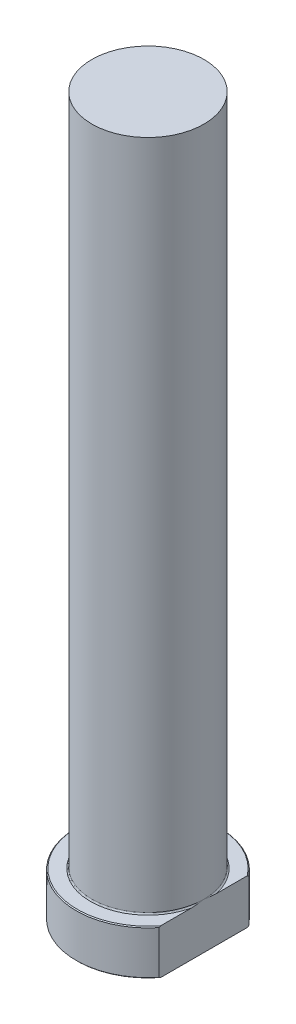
SolidWorks part; units mm, degrees
ref_plane "Front Plane" through (0, 0, 0) normal (0, 0, 1) x (1, 0, 0)
ref_plane "Top Plane" through (0, 0, 0) normal (0, 1, 0) x (1, 0, 0)
ref_plane "Right Plane" through (0, 0, 0) normal (1, 0, 0) x (0, 0, -1)
sketch "Sketch1" plane through (0, 0, 0) normal (0, 0, 1) x (1, 0, 0)
  line L0 (0, 259.9588) -> (0, -15.1925) construction
  line L1 (0, 0) -> (-16, 0)
  line L2 (-16, 0) -> (-16, 10)
  line L3 (-16, 10) -> (-12.5, 10)
  line L4 (-12.5, 10) -> (-12.5, 160)
  line L5 (-12.5, 160) -> (0, 160)
  line L6 (0, 160) -> (0, 0)
  dimension "L" = 160
  dimension "H" = 32
  dimension "T" = 10
  dimension "D" = 25
revolve "Revolve1" add sketch "Sketch1" angle 360 about L0
chamfer "Chamfer1" distance 0.2 angle 45 2 edges at (0, 10, 16) (0, 0, 16)
fillet "Fillet1" radius 0.3 1 edges at (0, 10, 12.5)
sketch "Sketch2" plane through (0, 0, 0) normal (0, 1, 0) x (1, 0, 0)
  line L0 (12.5, 9.9875) -> (12.5, -9.9875)
  circle A0 centre (0, 0) radius 16 construction
  arc A1 (12.5, -9.9875) -> (12.5, 9.9875) centre (0, 0) ccw
  circle A2 centre (0, 0) radius 12.5 construction
extrude "KEY" cut sketch "Sketch2" along normal through all
